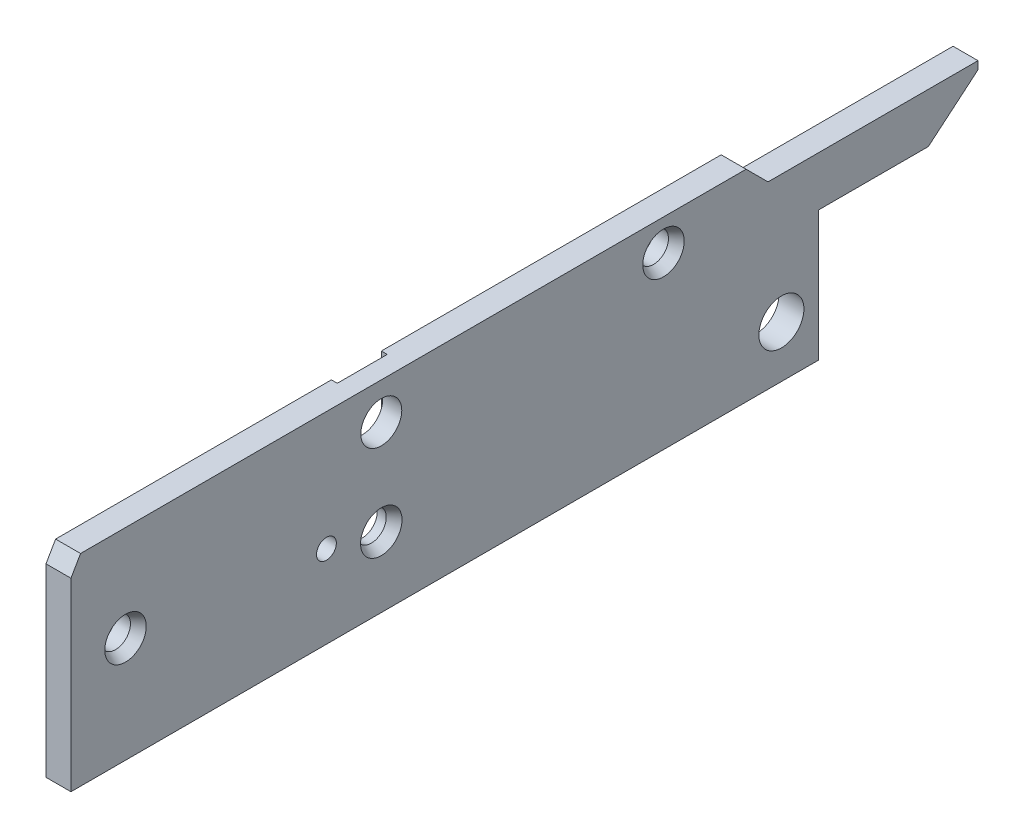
SolidWorks part; units mm, degrees
ref_plane "Спереди" through (0, 0, 0) normal (0, 0, 1) x (1, 0, 0)
ref_plane "Сверху" through (0, 0, 0) normal (0, 1, 0) x (1, 0, 0)
ref_plane "Справа" through (0, 0, 0) normal (1, 0, 0) x (0, 0, -1)
sketch "Эскиз1" plane through (0, 0, 0) normal (1, 0, 0) x (0, 0, -1)
  line L0 (-112.8014, -8.2042) -> (5.9182, -8.2042)
  line L1 (5.9182, -8.2042) -> (5.9182, 12.446)
  line L2 (5.9182, 12.446) -> (23.3284, 12.446)
  line L3 (23.3284, 12.446) -> (31.2166, 19.065)
  line L4 (31.2166, 19.065) -> (31.2166, 20.32)
  line L5 (31.2166, 20.32) -> (-2.1209, 20.32)
  line L6 (-2.1209, 20.32) -> (-5.6007, 23.7998)
  line L7 (-5.6007, 23.7998) -> (-111.2774, 23.7998)
  line L8 (-111.2774, 23.7998) -> (-112.8014, 21.1602)
  line L9 (-112.8014, 21.1602) -> (-112.8014, -8.2042)
  circle A0 centre (0, 0) radius 3.575
  circle A1 centre (-63.5254, 2.921) radius 2.3749
  circle A2 centre (-63.5254, 17.9832) radius 3.2512
  circle A3 centre (-72.2376, 4.9276) radius 1.5748
  circle A4 centre (-104.14, 8.5852) radius 2.3749
  circle A5 centre (-18.7198, 18.8468) radius 2.3749
  point P25 (0, 0)
  dimension "D4" = 7.1501
  dimension "D22" = 4.7498
  dimension "D23" = 3.1496
  dimension "D24" = 6.5024
  dimension "D1" = 7.874
  dimension "D2" = 50
  dimension "D3" = 5.461
  dimension "D5" = 8.2042
  dimension "D6" = 112.8014
  dimension "D7" = 30
  dimension "D8" = 45
  dimension "D9" = 118.7196
  dimension "D10" = 28.5242
  dimension "D11" = 144.018
  dimension "D12" = 33.3375
  dimension "D13" = 32.004
  dimension "D14" = 1.524
  dimension "D15" = 16.7894
  dimension "D16" = 13.1318
  dimension "D17" = 11.1252
  dimension "D18" = 15.0622
  dimension "D19" = 63.5254
  dimension "D20" = 72.2376
  dimension "D21" = 104.14
  dimension "D25" = 18.7198
  dimension "D26" = 27.051
extrude "Бобышка-Вытянуть1" add sketch "Эскиз1" along normal blind 3.9624
sketch "Эскиз2" plane through (0, 0, 0) normal (1, 0, 0) x (0, 0, -1)
  line L0 (-5.6007, 23.7998) -> (-111.2774, 23.7998) construction
  line L1 (-59.563, 23.7998) -> (-67.4878, 23.7998)
  line L2 (-59.563, 23.7998) -> (-59.563, -8.2042)
  line L3 (-59.563, -8.2042) -> (-67.4878, -8.2042)
  line L4 (-67.4878, 23.7998) -> (-67.4878, -8.2042)
  line L5 (-112.8014, -8.2042) -> (5.9182, -8.2042) construction
  line L6 (-63.5254, 17.9832) -> (-63.5254, 2.921) construction
  dimension "D1" = 7.9248
extrude "Вырез-Вытянуть1" cut sketch "Эскиз2" along normal offset from surface (0.9398 mm away) 3.0226
chamfer "Фаска1" distance 1.5875 angle 30 3 edges at (3.9624, 2.921, 61.1505) (3.9624, 8.5852, 101.7651) (3.9624, 18.8468, 16.3449)
chamfer "Фаска2" distance 1.1906 angle 30 1 edges at (0, 4.9276, 70.6628)
sketch "Эскиз3" plane through (3.9624, 0, 0) normal (1, 0, 0) x (0, 0, -1)
  line L0 (5.9182, 12.021) -> (22.8219, 12.021) construction
  line L2 (22.8219, 12.021) -> (28.7105, 16.9621) construction
  line L3 (28.7105, 16.9621) -> (47.7272, 16.9621) construction
  line L4 (5.9182, -8.2042) -> (5.9182, 12.446) construction
  line L5 (5.9182, 12.446) -> (23.3284, 12.446) construction
  line L6 (23.3284, 12.446) -> (31.2166, 19.065) construction
  spline S0 degree 3 poles (5.9182, 12.021) (11.4939, 12.021) (17.0697, 12.021) (22.6454, 12.021) (22.6823, 12.021) (22.756, 12.021) (22.8724, 12.0634) (22.9289, 12.1108) (22.9572, 12.1345) (24.8299, 13.7059) (26.7025, 15.2773) (28.5752, 16.8486) (28.6035, 16.8723) (28.66, 16.9197) (28.7764, 16.9621) (28.8501, 16.9621) (28.887, 16.9621) (35.1671, 16.9621) (41.4471, 16.9621) (47.7272, 16.9621) knots 0 0 0 0 0.383961 0.383961 0.383961 0.386499 0.389038 0.391577 0.391577 0.391577 0.559921 0.559921 0.559921 0.562459 0.564998 0.567536 0.567536 0.567536 1 1 1 1
  dimension "D1" = 4.5161
  dimension "D2" = 0.425
surface "Поверхность-Вытянуть1" sketch "Эскиз3" parameters "D1"=2.54
